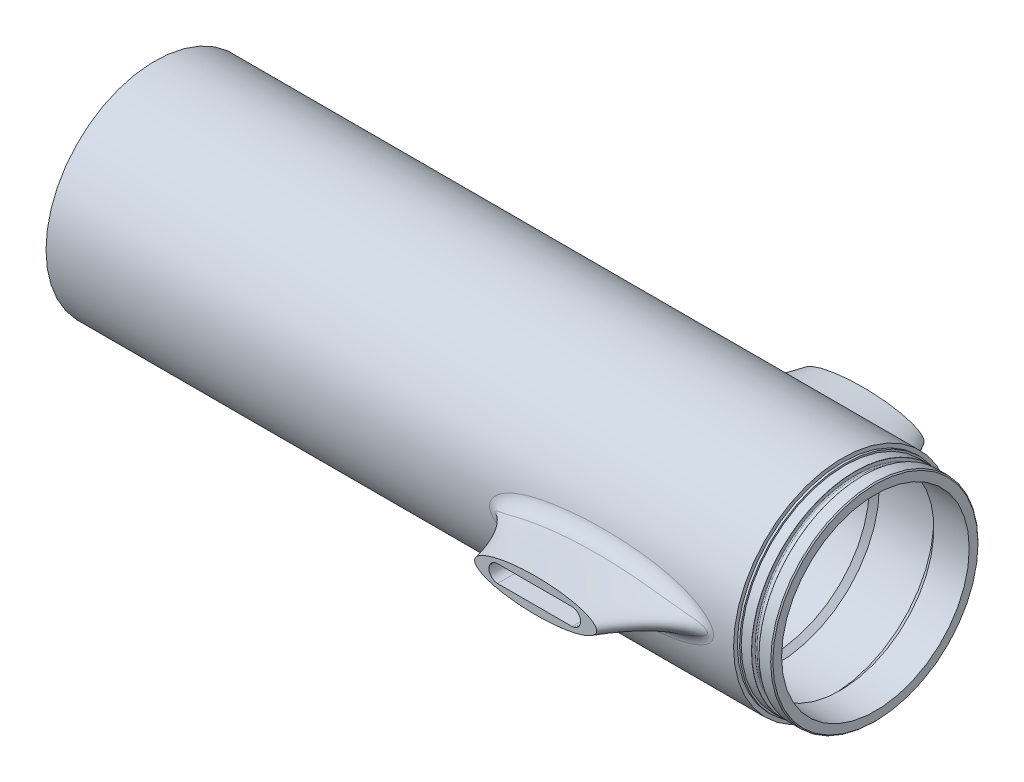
SolidWorks part; units mm, degrees
ref_plane "Plan de face" through (0, 0, 0) normal (0, 0, 1) x (1, 0, 0)
ref_plane "Plan de dessus" through (0, 0, 0) normal (0, 1, 0) x (1, 0, 0)
ref_plane "Plan de droite" through (0, 0, 0) normal (1, 0, 0) x (0, 0, -1)
sketch "Esquisse1" plane through (0, 0, 0) normal (0, 0, 1) x (1, 0, 0)
  line L0 (-4.5426, 0) -> (690.2142, 0) construction
  line L1 (32, 95) -> (3, 95)
  line L2 (40, 85.5) -> (48, 85.5)
  line L3 (0, 96.5) -> (0, 100)
  line L4 (0, 100) -> (630, 100)
  line L5 (660, 86) -> (660, 95)
  line L6 (200, 93.6) -> (204.6, 89)
  line L7 (265, 93.6) -> (260.4, 89)
  line L8 (265, 93.6) -> (435, 93.6)
  line L9 (435, 93.6) -> (439.6, 89)
  line L10 (570, 93.6) -> (565.4, 89)
  line L11 (570, 93.6) -> (620, 93.6)
  line L12 (620, 93.6) -> (627.6, 86)
  line L13 (627.6, 86) -> (660, 86)
  line L14 (439.6, 89) -> (565.4, 89)
  line L15 (40, 93.6) -> (40, 85.5)
  line L16 (48, 93.6) -> (48, 85.5)
  line L17 (204.6, 89) -> (260.4, 89)
  line L18 (48, 93.6) -> (200, 93.6)
  line L19 (630, 100) -> (630, 96.5)
  line L20 (632, 95) -> (641.4, 95)
  line L21 (0, 96.5) -> (2, 96.5)
  line L22 (3, 95.5) -> (3, 95)
  line L23 (40, 93.6) -> (34, 93.6)
  line L24 (34, 93.6) -> (32, 95)
  line L25 (648.4, 95) -> (660, 95)
  line L27 (648.3, 94.9) -> (648.3, 91.9)
  line L28 (647.3, 90.9) -> (642.5, 90.9)
  line L29 (641.5, 94.9) -> (641.5, 91.9)
  line L32 (630, 96.5) -> (632, 96.5)
  line L33 (632, 95) -> (632, 96.5)
  arc A0 (2, 96.5) -> (3, 95.5) centre (2, 95.5) cw
  arc A1 (648.3, 91.9) -> (647.3, 90.9) centre (647.3, 91.9) cw
  arc A2 (642.5, 90.9) -> (641.5, 91.9) centre (642.5, 91.9) cw
  arc A3 (648.4, 95) -> (648.3, 94.9) centre (648.4, 94.9) ccw
  arc A4 (641.4, 95) -> (641.5, 94.9) centre (641.4, 94.9) cw
  point P27 (3, 96.5)
  point P40 (648.3, 95)
  dimension "D21" = 1
  dimension "D28" = 1
  dimension "D29" = 0.1
  dimension "D1" = 660
  dimension "D2" = 100
  dimension "D4" = 93.6
  dimension "D5" = 200
  dimension "D6" = 65
  dimension "D7" = 435
  dimension "D8" = 135
  dimension "D9" = 135
  dimension "D10" = 50
  dimension "D11" = 135
  dimension "D12" = 45
  dimension "D13" = 135
  dimension "D14" = 40
  dimension "D15" = 8
  dimension "D16" = 95
  dimension "D17" = 95
  dimension "D18" = 30
  dimension "D19" = 3
  dimension "D20" = 1.5
  dimension "D22" = 2
  dimension "D23" = 6
  dimension "D24" = 11.5
  dimension "D25" = 6.8
  dimension "D26" = 86
  dimension "D27" = 4.1
  dimension "D30" = 1.5
  dimension "D31" = 2
  dimension "D32" = 85.5
revolve "Révolution1" add sketch "Esquisse1" angle 360 about L0
ref_plane "Plan1" through (0, 0, 150) normal (0, 0, 1) x (1, 0, 0)
ref_plane "Plan2" through (0, 0, 97) normal (0, 0, 1) x (1, 0, 0)
sketch "Esquisse2" plane through (0, 0, 150) normal (0, 0, 1) x (1, 0, 0)
  line L0 (-124.6882, 0) -> (804.7582, 0) construction
  ellipse E0 centre (498.7024, 0) end of major axis (554.6, 0) minor radius 15.3505
  point P3 (450.6, 8)
  point P4 (550.6, -8)
  point P5 (450.6, -8)
  point P6 (550.6, 8)
  point P7 (458.6, -8)
  point P9 (446.6, -12)
  point P10 (554.6, -12)
  point P11 (554.6, 12)
  point P12 (446.6, 12)
  point P13 (458.6, 0)
  point P16 (458.6, 8)
sketch "Esquisse6" plane through (0, 0, 97) normal (0, 0, 1) x (1, 0, 0)
  ellipse E0 centre (513.3374, 0) end of major axis (396.6748, 0) minor radius 22.1382
sketch "Esquisse5" plane through (0, 0, 0) normal (0, 1, 0) x (1, 0, 0)
  line L0 (636.4846, -97) -> (623.5154, -97) construction
  line L1 (396.6748, -97) -> (630, -97) construction
  spline S0 degree 2 poles (554.2261, -150) (584.6081, -97) (630, -97) knots 0 0 0 1 1 1
sketch "Esquisse7" plane through (0, 0, 0) normal (0, 1, 0) x (1, 0, 0)
  line L0 (-124.6882, -150) -> (804.7582, -150) construction
  line L1 (396.6748, -97) -> (630, -97) construction
  spline S0 degree 2 poles (442.8049, -150) (428.088, -97.666) (396.6748, -97) knots 0 0 0 1 1 1
loft "Lissage3" add profiles "Esquisse2", "Esquisse6"
fillet "Congé2" radius 15 1 edges at (410.6029, 1.9822, 99.9804)
chamfer "Chanfrein1" distance 1 angle 45 1 edges at (660, 0, 95)
sketch "Esquisse3" plane through (40, 0, 0) normal (-1, 0, 0) x (0, 0, 1)
  circle A0 centre (0, -89) radius 2.25
  dimension "D2" = 4.5
  dimension "D1" = 89
extrude "Enlèv. mat.-Extru.1" cut sketch "Esquisse3" against normal blind 10
pattern_circular "Répétition circulaire1" count 8 over 360 about axis through (0, 0, 0) along (1, 0, 0) of "Enlèv. mat.-Extru.1"
sketch "Esquisse8" plane through (0, 0, 150) normal (0, 0, 1) x (1, 0, 0)
  line L0 (463.7083, 0) -> (531.9445, 0) construction
  line L1 (-124.6882, 0) -> (804.7582, 0) construction
  line L2 (565.4, 0) -> (439.6, 0) construction
  line L3 (463.7083, 7.875) -> (531.9445, 7.875)
  line L4 (463.7083, -7.875) -> (531.9445, -7.875)
  arc A0 (463.7083, 7.875) -> (463.7083, -7.875) centre (463.7083, 0) ccw
  arc A1 (531.9445, -7.875) -> (531.9445, 7.875) centre (531.9445, 0) ccw
  point P7 (497.8264, 0)
extrude "Enlèv. mat.-Extru.2" cut sketch "Esquisse8" against normal blind 20
mirror "Symétrie1" about plane through (0, 0, 0) normal (0, 0, 1) of "Enlèv. mat.-Extru.2", "Congé2", "Lissage3"
sketch "Esquisse9" plane through (0, 0, 0) normal (0, 0, 1) x (1, 0, 0)
  line L0 (611.7012, 0) -> (668.8425, 0)
  line L1 (-15.4504, 0) -> (406.441, 0)
  line L2 (-15.4504, -111.8715) -> (-15.4504, 111.8715)
  line L3 (-15.4504, 111.8715) -> (668.8425, 111.8715)
  line L4 (668.8425, -111.8715) -> (668.8425, 111.8715)
  line L5 (-15.4504, -111.8715) -> (668.8425, -111.8715)
  spline S0 degree 3 number of poles 163 (611.7012, 0) -> (611.7012, 0) construction
  spline S1 degree 3 number of poles 86 (611.7012, 0) -> (406.441, 0)
  spline S2 degree 3 number of poles 86 (611.7012, 0) -> (406.441, 0)
extrude "Enlèv. mat.-Extru.3" [suppressed] cut sketch "Esquisse9" against normal through all contours S1 L0 L4 L3 L2 L1 | L0 S2 L1 L2 L5 L4
